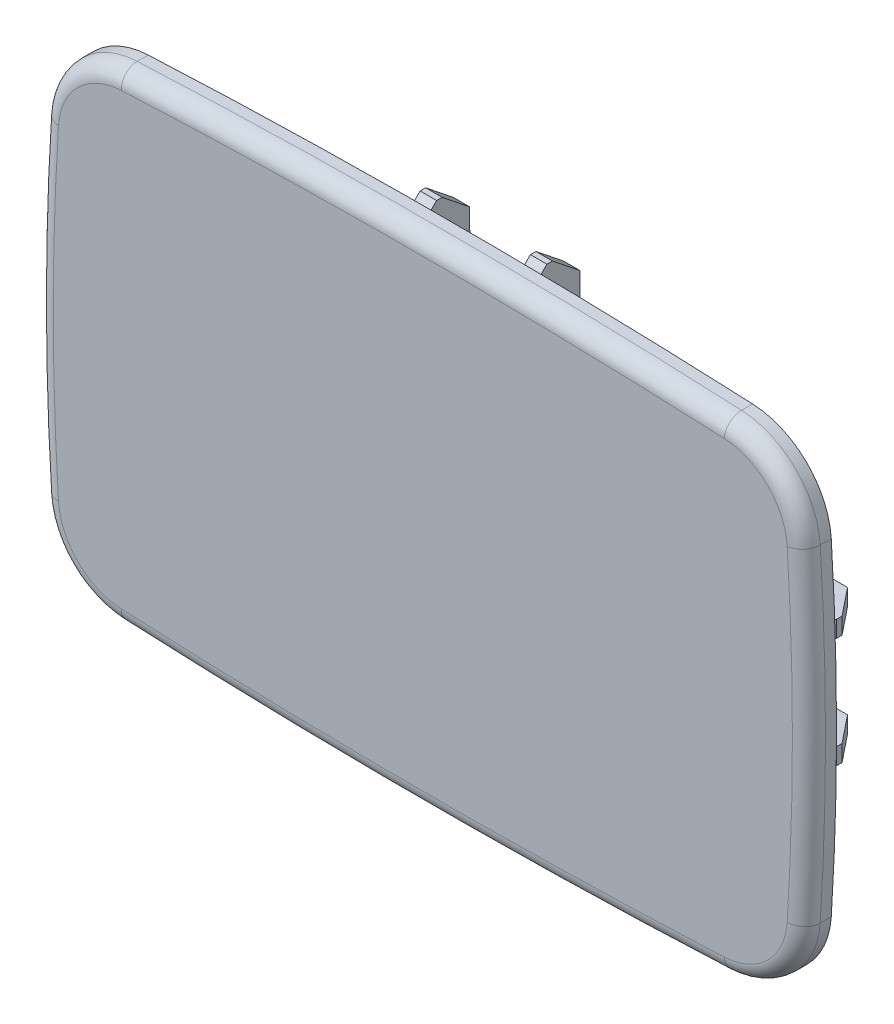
SolidWorks part; units mm, degrees
ref_plane "Front" through (0, 0, 0) normal (0, 0, 1) x (1, 0, 0)
ref_plane "Top" through (0, 0, 0) normal (0, 1, 0) x (1, 0, 0)
ref_plane "Right" through (0, 0, 0) normal (1, 0, 0) x (0, 0, -1)
sketch "Sketch1" plane through (0, 0, 0) normal (0, 0, 1) x (1, 0, 0)
  line L0 (0, 0) -> (0, 45)
  line L1 (0, 0) -> (-70, 0)
  line L2 (0, 45) -> (31.4733, 45) construction
  line L3 (-70, 0) -> (-70, -21.0227) construction
  arc A0 (-70, 0) -> (-69.0482, 29.6799) centre (393.25, 0) cw
  arc A1 (-54.7894, 43.702) -> (0, 45) centre (0, -1112) cw
  arc A2 (-69.0482, 29.6799) -> (-54.7894, 43.702) centre (-54.0791, 28.7188) cw
  point P11 (-68, 43)
  dimension "D5" = 15
  dimension "D1" = 70
  dimension "D2" = 45
  dimension "D3" = 2
  dimension "D4" = 2
extrude "Boss-Extrude1" add sketch "Sketch1" along normal blind 5
mirror "Mirror1" about plane through (0, 0, 0) normal (1, 0, 0)
mirror "Mirror2" about plane through (0, 0, 0) normal (0, 1, 0)
fillet "Fillet1" radius 3 8 edges at (-64.5965, 39.4138, 5) (0, 45, 5) (64.5965, 39.4138, 5) (70, 0, 5) (64.5965, -39.4138, 5) (0, -45, 5) (-64.5965, -39.4138, 5) (-70, 0, 5)
shell "Shell1" thickness 2
sketch "Sketch3" plane through (0, 0, 0) normal (0, 0, 1) x (1, 0, 0)
  line L0 (0, 31) -> (0, 0) construction
  line L1 (64, 10) -> (54, 10)
  line L2 (10, 36) -> (-10, 36) construction
  line L3 (64, -10) -> (54, -10)
  line L4 (54, 10) -> (54, -10)
  line L5 (-64, -10) -> (-54, -10)
  line L6 (10, 41) -> (10, 31)
  line L7 (10, 31) -> (-10, 31)
  line L8 (-10, 41) -> (-10, 31)
  line L9 (0, 0) -> (54, 0) construction
  line L10 (59, -10) -> (59, 10) construction
  line L11 (-54, 10) -> (-54, -10)
  line L12 (-64, 10) -> (-54, 10)
  line L13 (-10, -41) -> (-10, -31)
  line L14 (10, -31) -> (-10, -31)
  line L15 (10, -41) -> (10, -31)
  dimension "D1" = 20
  dimension "D2" = 118
  dimension "D3" = 10
  dimension "D4" = 72
extrude "Extrude-Thin1" add sketch "Sketch3" against normal blind 12 and the other way up to body thin
sketch "Sketch4" plane through (0, 0, 0) normal (0, 1, 0) x (1, 0, 0)
  line L0 (-60, -3) -> (-60, 2)
  line L1 (-60, 2) -> (-64, 6)
  line L2 (-64, 12) -> (-64, -3) construction
  line L3 (-64, 6) -> (-64, 7)
  line L4 (-64, 7) -> (-60, 12)
  line L5 (-64, 12) -> (-52.5, 12) construction
  line L6 (-60, 12) -> (-65, 12)
  line L7 (-65, 12) -> (-65, -3)
  line L8 (-65, -3) -> (-60, -3)
  line L10 (-52.5, -3) -> (-64, -3) construction
  line L11 (0, 0) -> (0, 16.1921) construction
  line L12 (65, -3) -> (60, -3)
  line L13 (65, 12) -> (65, -3)
  line L14 (60, 12) -> (65, 12)
  line L15 (64, 7) -> (60, 12)
  line L16 (64, 6) -> (64, 7)
  line L17 (60, 2) -> (64, 6)
  line L18 (60, -3) -> (60, 2)
  point P15 (-60, 6)
  point P16 (-60, 6)
  point P26 (-60.5145, 4.0375)
  point P27 (-60, 12)
  dimension "D1" = 4
  dimension "D2" = 6
  dimension "D3" = 45
  dimension "D4" = 1
  dimension "D5" = 1
extrude "Cut-Extrude1" cut sketch "Sketch4" against normal mid plane 30
sketch "Sketch5" plane through (0, 0, 0) normal (1, 0, 0) x (0, 0, -1)
  line L0 (12, 37) -> (7, 41)
  line L1 (12, 29.5) -> (12, 41) construction
  line L2 (12, 41) -> (-3, 41) construction
  line L3 (7, 41) -> (6, 41)
  line L4 (6, 41) -> (2, 37)
  line L5 (2, 37) -> (-3, 37)
  line L6 (-3, 37) -> (-3, 42)
  line L7 (-3, 42) -> (12, 42)
  line L8 (12, 42) -> (12, 37)
  line L9 (-3, 41) -> (-3, 29.5) construction
  line L11 (0, 0) -> (15.4478, 0) construction
  line L12 (12, -42) -> (12, -37)
  line L13 (-3, -42) -> (12, -42)
  line L14 (-3, -37) -> (-3, -42)
  line L15 (2, -37) -> (-3, -37)
  line L16 (6, -41) -> (2, -37)
  line L17 (7, -41) -> (6, -41)
  line L18 (12, -37) -> (7, -41)
  point P15 (5.1588, 37.0895)
  point P25 (12, 39.5507)
  dimension "D1" = 1
  dimension "D2" = 1
  dimension "D3" = 4
  dimension "D4" = 6
  dimension "D5" = 45
extrude "Cut-Extrude2" cut sketch "Sketch5" against normal mid plane 30
fillet "Fillet2" radius 1 8 edges at (8.5, -32.5, -4.5) (-8.5, -32.5, -4.5) (-55.5, 8.5, -4.5) (-55.5, -8.5, -4.5) (-8.5, 32.5, -4.5) (8.5, 32.5, -4.5) (55.5, -8.5, -4.5) (55.5, 8.5, -4.5)
fillet "Fillet3" radius 3 8 edges at (52.5, 11.5, -4.5) (52.5, -11.5, -4.5) (11.5, -29.5, -4.5) (-11.5, -29.5, -4.5) (-52.5, 11.5, -4.5) (-52.5, -11.5, -4.5) (-11.5, 29.5, -4.5) (11.5, 29.5, -4.5)
fillet "Fillet4" radius 3 48 edges at (8.5, 35.25, 3) (8.2071, 32.7929, 3) (-8.5, 35.25, 3) (-8.2071, 32.7929, 3) (11.5, -34.75, 3) (10.6213, -30.3787, 3) (0, -29.5, 3) (-10.6213, -30.3787, 3) (-58.25, -8.5, 3) (-55.7929, -8.2071, 3) (-55.5, 0, 3) (-55.7929, 8.2071, 3) (-57.75, 11.5, 3) (-53.3787, 10.6213, 3) (-52.5, 0, 3) (-53.3787, -10.6213, 3) (58.25, -8.5, 3) (55.7929, -8.2071, 3) (55.5, 0, 3) (55.7929, 8.2071, 3) (57.75, 11.5, 3) (53.3787, 10.6213, 3) (52.5, 0, 3) (53.3787, -10.6213, 3) (-8.5, -35.25, 3) (-8.2071, -32.7929, 3) (8.5, -35.25, 3) (8.2071, -32.7929, 3) (11.5, 34.75, 3) (10.6213, 30.3787, 3) (-11.5, 34.75, 3) (-10.6213, 30.3787, 3) (-10, 37, 3) (0, 32.5, 3) (10, 37, 3) (60, 10, 3) (60, -10, 3) (-60, 10, 3) (-60, -10, 3) (-10, -37, 3) (10, -37, 3) (-11.5, -34.75, 3) (-58.25, 8.5, 3) (-57.75, -11.5, 3) (58.25, 8.5, 3) (57.75, -11.5, 3) (0, -32.5, 3) (0, 29.5, 3)
